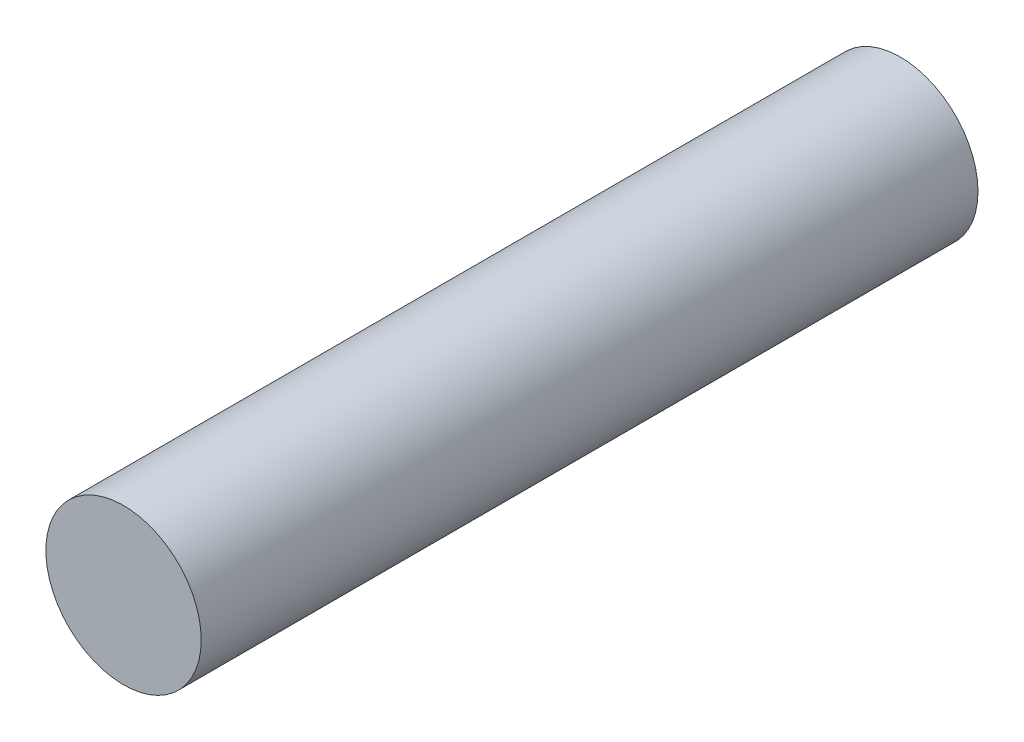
SolidWorks part; units mm, degrees
ref_plane "Ebene vorne" through (0, 0, 0) normal (0, 0, 1) x (1, 0, 0)
ref_plane "Ebene oben" through (0, 0, 0) normal (0, 1, 0) x (1, 0, 0)
ref_plane "Ebene rechts" through (0, 0, 0) normal (1, 0, 0) x (0, 0, -1)
sketch "Skizze1" plane through (0, 0, 0) normal (0, 0, 1) x (1, 0, 0)
  circle A0 centre (0, 0) radius 15
  dimension "D1" = 30
extrude "Aufsatz-Linear austragen1" add sketch "Skizze1" along normal blind 150
